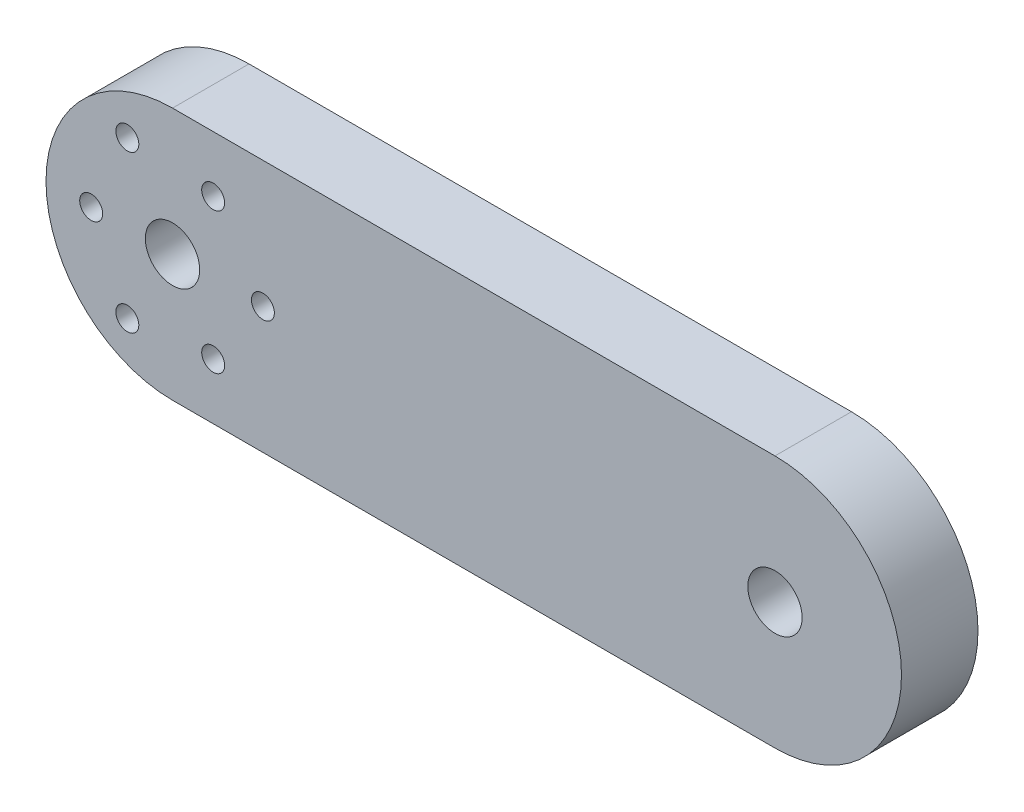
SolidWorks part; units mm, degrees
ref_plane "Front Plane" through (0, 0, 0) normal (0, 0, 1) x (1, 0, 0)
ref_plane "Top Plane" through (0, 0, 0) normal (0, 1, 0) x (1, 0, 0)
ref_plane "Right Plane" through (0, 0, 0) normal (1, 0, 0) x (0, 0, -1)
sketch "Sketch1" plane through (0, 0, 0) normal (0, 0, 1) x (1, 0, 0)
  line L0 (0, 0) -> (100, 0) construction
  line L1 (0, 21) -> (100, 21)
  line L2 (0, -21) -> (100, -21)
  arc A1 (0, 21) -> (0, -21) centre (0, 0) ccw
  arc A2 (100, -21) -> (100, 21) centre (100, 0) ccw
  circle A3 centre (100, 0) radius 4.5085
  circle A4 centre (0, 0) radius 15 construction
  circle A5 centre (15, 0) radius 1.905
  circle A6 centre (-7.5, -12.9904) radius 1.905
  circle A7 centre (-7.5, 12.9904) radius 1.905
  circle A8 centre (0, 0) radius 4.5085
  circle A9 centre (0, 0) radius 13.5 construction
  circle A10 centre (-13.5, 0) radius 1.905
  circle A11 centre (6.75, 11.6913) radius 1.905
  circle A12 centre (6.75, -11.6913) radius 1.905
  point P3 (50, 0)
  point P20 (0, 0)
  point P29 (0, 0)
  dimension "D1" = 9.017
  dimension "D2" = 30
  dimension "D3" = 3.81
  dimension "D5" = 9.017
  dimension "D6" = 27
  dimension "D7" = 3.81
  dimension "D4" = 3
  dimension "D8" = 3
extrude "Boss-Extrude2" add sketch "Sketch1" along normal blind 12.7
